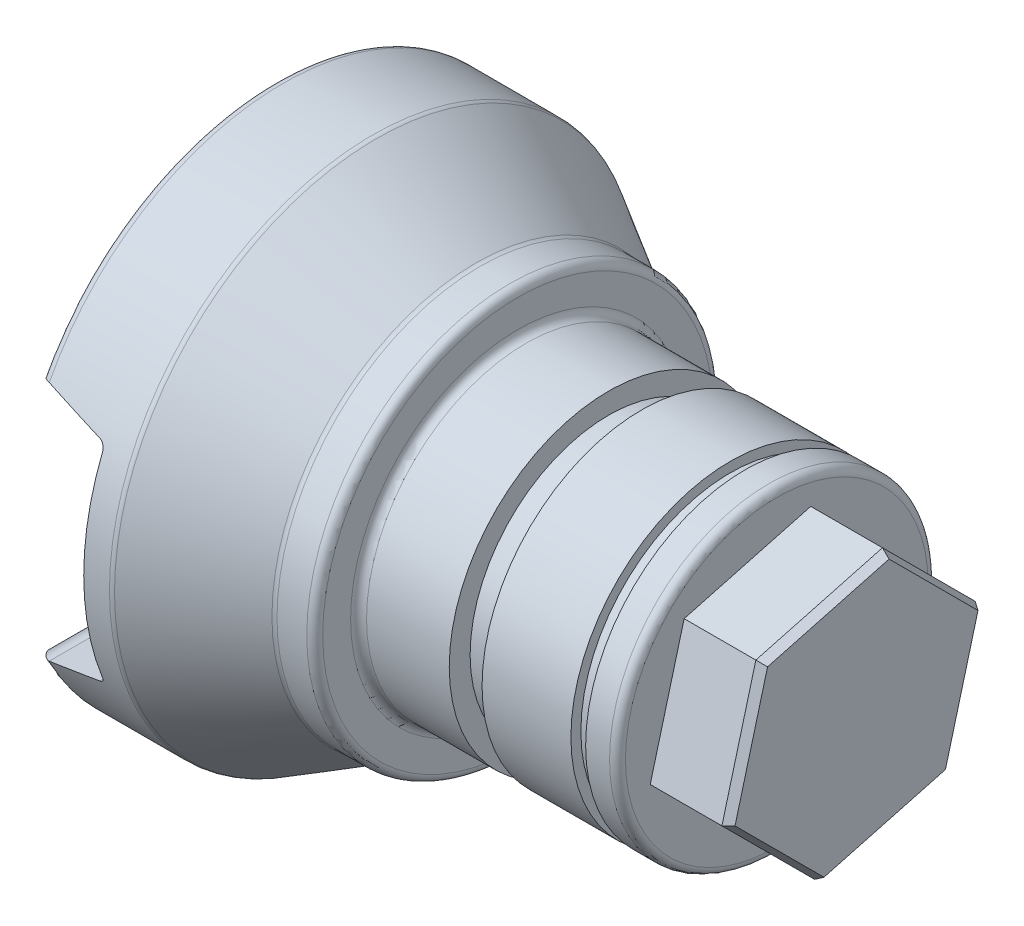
SolidWorks part; units mm, degrees
ref_plane "Plan1" through (0, 0, 0) normal (0, 0, 1) x (1, 0, 0)
ref_plane "Plan2" through (0, 0, 0) normal (0, 1, 0) x (1, 0, 0)
ref_plane "Plan3" through (0, 0, 0) normal (1, 0, 0) x (0, 0, -1)
sketch "Esquisse2" plane through (0, 0, 0) normal (0, 0, 1) x (1, 0, 0)
  line L0 (40, 0) -> (120, 0) construction
  line L1 (-69, 33) -> (-57.7679, 33)
  line L2 (-70, 23.5) -> (-57.7679, 23.5)
  line L3 (-70, 32) -> (-70, 23.5)
  line L4 (-44.2417, 25.5) -> (-40.5, 25.5)
  line L5 (-44.7417, 25.634) -> (-57.2679, 32.866)
  line L6 (-11, 20) -> (-8, 20)
  line L7 (-16, 4.6639) -> (-16, 0)
  line L8 (-57.2679, 23.366) -> (-51.3775, 19.9652)
  line L9 (-7, 19) -> (-7, 0)
  line L10 (-39.5, 24.5) -> (-39.5, 21)
  line L11 (-38.5, 20) -> (-28.12, 20)
  line L12 (-24, 20) -> (-12.85, 20)
  line L13 (-12.85, 20) -> (-12.85, 18.75)
  line L14 (-44.8682, 12.2715) -> (-18.4791, 7.6183)
  line L15 (-16, 0) -> (-7, 0)
  line L16 (-12.85, 18.75) -> (-11, 18.75)
  line L17 (-11, 20) -> (-11, 18.75)
  line L19 (-28.12, 20) -> (-28.12, 17.38)
  line L20 (-28.12, 17.38) -> (-24, 17.38)
  line L21 (-24, 20) -> (-24, 17.38)
  arc A0 (-44.8682, 12.2715) -> (-48.9387, 16.4153) centre (-44, 17.1955) cw
  arc A1 (-16, 4.6639) -> (-18.4791, 7.6183) centre (-19, 4.6639) ccw
  arc A2 (-48.9387, 16.4153) -> (-51.3775, 19.9652) centre (-53.8775, 15.635) ccw
  arc A3 (-69, 33) -> (-70, 32) centre (-69, 32) ccw
  arc A4 (-7, 19) -> (-8, 20) centre (-8, 19) ccw
  arc A5 (-39.5, 24.5) -> (-40.5, 25.5) centre (-40.5, 24.5) ccw
  arc A6 (-38.5, 20) -> (-39.5, 21) centre (-38.5, 21) cw
  arc A7 (-57.2679, 23.366) -> (-57.7679, 23.5) centre (-57.7679, 22.5) ccw
  arc A8 (-44.2417, 25.5) -> (-44.7417, 25.634) centre (-44.2417, 26.5) cw
  arc A9 (-57.2679, 32.866) -> (-57.7679, 33) centre (-57.7679, 32) ccw
  point P19 (-49, 13)
  point P25 (-16, 7.1812)
  point P31 (-70, 33)
  point P34 (-7, 20)
  point P41 (-44.5096, 25.5)
  dimension "D9" = 5
  dimension "D11" = 3
  dimension "D12" = 5
  dimension "D13" = 1
  dimension "D5" = 1
  dimension "D14" = 1
  dimension "D1" = 23.5
  dimension "D2" = 33
  dimension "D3" = 25.5
  dimension "D4" = 30
  dimension "D6" = 9
  dimension "D7" = 59
  dimension "D8" = 20
  dimension "D10" = 30.5
  dimension "D15" = 4
  dimension "D16" = 17
  dimension "D17" = 18.75
  dimension "D18" = 1.85
  dimension "D19" = 2.62
revolve "Base-Révolution" add sketch "Esquisse2" angle 360 about L0
ref_plane "Plan4" through (0, 0, 33) normal (0, 0, 1) x (1, 0, 0)
sketch "Esquisse3" plane through (0, 0, 33) normal (0, 0, 1) x (1, 0, 0)
  line L0 (20, 0) -> (-90, 0) construction
  line L1 (-61, 12.2327) -> (-61, -12.2327)
  line L3 (-70, 32) -> (-70, -32) construction
  line L4 (-70.2684, 14.1802) -> (-70.2684, -14.1802)
  line L6 (-61.7412, 13.1986) -> (-69.0096, 15.1462)
  line L7 (-61.7412, -13.1986) -> (-69.0096, -15.1462)
  arc A0 (-61, 12.2327) -> (-61.7412, 13.1986) centre (-62, 12.2327) ccw
  arc A1 (-61, -12.2327) -> (-61.7412, -13.1986) centre (-62, -12.2327) cw
  arc A2 (-69.0096, 15.1462) -> (-70.2684, 14.1802) centre (-69.2684, 14.1802) ccw
  arc A3 (-70.2684, -14.1802) -> (-69.0096, -15.1462) centre (-69.2684, -14.1802) ccw
  dimension "D1" = 1
  dimension "D3" = 1
  dimension "D2" = 9
extrude "Enlèv. mat.-Extru.1" cut sketch "Esquisse3" against normal through all
sketch "Esquisse4" plane through (-7, 0, 0) normal (1, 0, 0) x (0, 0, -1)
  line L1 (11.6351, -11.6351) -> (15.8938, 4.2587)
  line L2 (15.8938, 4.2587) -> (4.2587, 15.8938)
  line L3 (4.2587, 15.8938) -> (-11.6351, 11.6351)
  line L4 (-11.6351, 11.6351) -> (-15.8938, -4.2587)
  line L5 (-15.8938, -4.2587) -> (-4.2587, -15.8938)
  line L6 (-4.2587, -15.8938) -> (11.6351, -11.6351)
  circle A0 centre (0, 0) radius 14.25 construction
  dimension "D1" = 28.5
extrude "Boss.-Extru.1" add sketch "Esquisse4" along normal blind 10
chamfer "Chanfrein1" distance 1 angle 30 6 edges at (3, -13.7644, -3.6882) (3, -3.6882, -13.7644) (3, 10.0763, -10.0763) (3, 13.7644, 3.6882) (3, 3.6882, 13.7644) (3, -10.0763, 10.0763)
